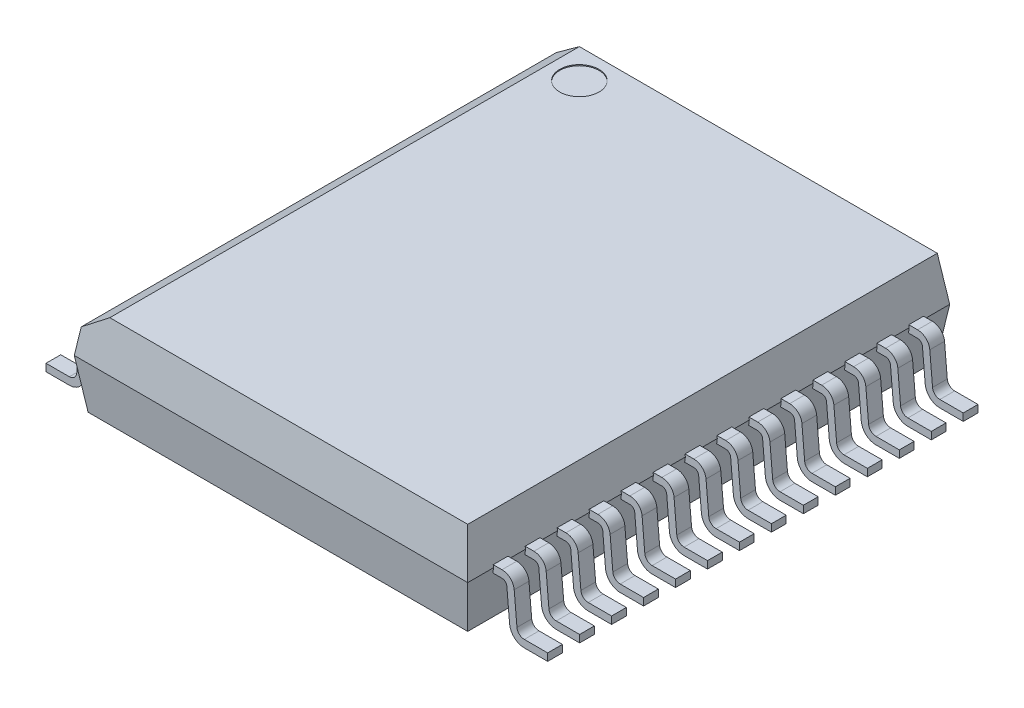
SolidWorks part; units mm, degrees
ref_plane "Front" through (0, 0, 0) normal (0, 0, 1) x (1, 0, 0)
ref_plane "Top" through (0, 0, 0) normal (0, 1, 0) x (1, 0, 0)
ref_plane "Right" through (0, 0, 0) normal (1, 0, 0) x (0, 0, -1)
ref_plane "ПлоскостьВывод1" through (0, 0, -4.225) normal (0, 0, 1) x (1, 0, 0)
sketch "ЭскизВывод1" plane through (0, 0, -4.225) normal (0, 0, 1) x (1, 0, 0)
  line L0 (-5.1, 0) -> (-4.6249, 0)
  line L1 (-4.326, 0.2739) -> (-4.2705, 0.9087)
  line L2 (-4.1709, 1) -> (4.1709, 1)
  line L3 (0, 1) -> (0, 0) construction
  line L4 (4.326, 0.2739) -> (4.2705, 0.9087)
  line L5 (5.1, 0) -> (4.6249, 0)
  arc A0 (-4.2705, 0.9087) -> (-4.1709, 1) centre (-4.1709, 0.9) cw
  arc A1 (-4.6249, 0) -> (-4.326, 0.2739) centre (-4.6249, 0.3) ccw
  arc A2 (4.6249, 0) -> (4.326, 0.2739) centre (4.6249, 0.3) cw
  arc A3 (4.2705, 0.9087) -> (4.1709, 1) centre (4.1709, 0.9) ccw
  point P8 (-4.2625, 1)
  point P11 (-4.35, 0)
  dimension "D6" = 0.1
  dimension "D7" = 0.3
  dimension "E" = 10.2
  dimension "A_mid_lead" = 1
  dimension "L" = 0.75
  dimension "D4" = 85
  dimension "D5" = 8.525
extrude "Вывод1" add sketch "ЭскизВывод1" along normal mid plane 0.3 thin
ref_plane "ПлоскостьКорпус" through (0, 1.1, 0) normal (0, 1, 0) x (-1, 0, 0)
sketch "ЭскизКорпус" plane through (0, 1.1, 0) normal (0, 1, 0) x (1, 0, 0)
  line L1 (4, -4.9) -> (-4, -4.9)
  line L2 (4, -4.9) -> (4, 4.9)
  line L3 (4, 4.9) -> (-4, 4.9)
  line L4 (-4, -4.9) -> (-4, 4.9)
  line L5 (4, -4.9) -> (-4, 4.9) construction
  line L6 (4, 4.9) -> (-4, -4.9) construction
  point P0 (0, 0)
  dimension "D" = 9.8
  dimension "E" = 8
extrude "Корпус" add sketch "ЭскизКорпус" along normal offset from surface 2 draft 8 and the other way offset from surface (1 mm away) 0.1 draft 8
pattern_linear "Выводы" count 14 spacing 0.65 along (0, 0, 1) of "Вывод1"
chamfer "Фаска1" distance 0.4 angle 45 1 edges at (-3.8735, 2, 0)
sketch "Эскиз3" plane through (0, 2, 0) normal (0, 1, 0) x (1, 0, 0)
  line L0 (-3.4035, 4.1735) -> (-2.8035, 4.1735) construction
  line L1 (-3.4035, 4.7735) -> (-3.4035, -4.7735) construction
  line L2 (-2.8035, 4.1735) -> (-2.8035, 4.7735) construction
  line L3 (3.8735, 4.7735) -> (-3.4035, 4.7735) construction
  circle A0 centre (-2.8035, 4.1735) radius 0.4
  dimension "D2" = 0.8
  dimension "D1" = 0.6
extrude "Вытянуть3" cut sketch "Эскиз3" against normal blind 0.02
sketch "SkThermalPad" plane through (0, 1.1, 0) normal (0, 1, 0) x (-1, 0, 0)
  line L1 (1.25, 1.25) -> (-1.25, 1.25)
  line L2 (1.25, 1.25) -> (1.25, -1.25)
  line L3 (1.25, -1.25) -> (-1.25, -1.25)
  line L4 (-1.25, 1.25) -> (-1.25, -1.25)
  line L5 (1.25, 1.25) -> (-1.25, -1.25) construction
  line L6 (1.25, -1.25) -> (-1.25, 1.25) construction
  point P0 (0, 0)
  dimension "D1" = 2.5
  dimension "E2" = 2.5
extrude "ThermalPad" [suppressed] add sketch "SkThermalPad" against normal up to surface (0.95 mm away)
